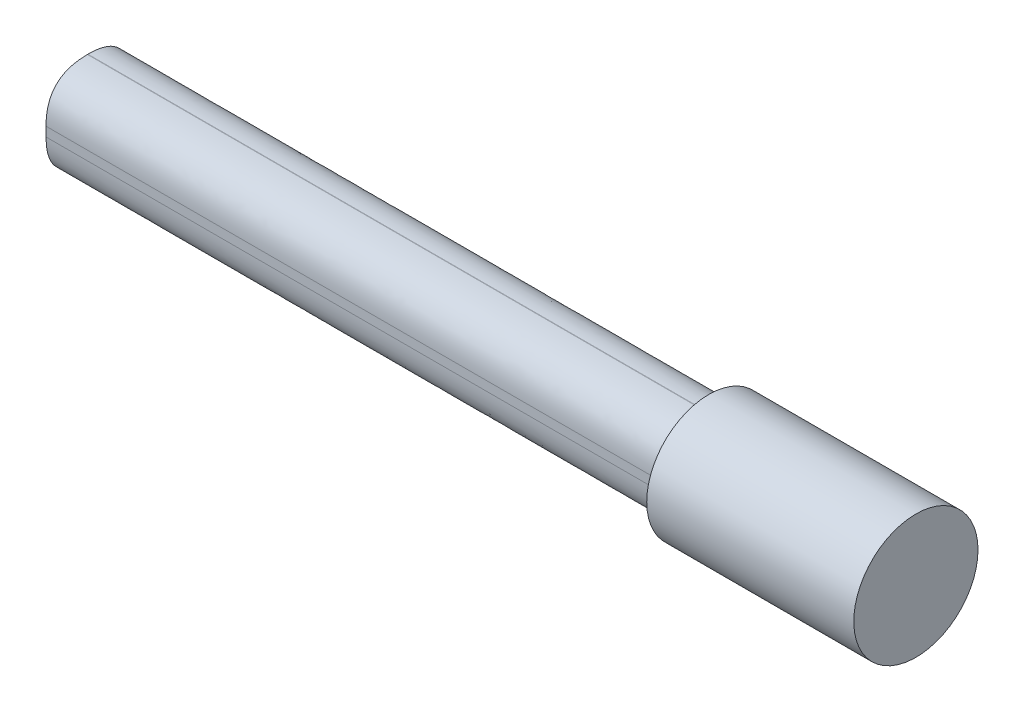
SolidWorks part; units mm, degrees
ref_plane "Front Plane" through (0, 0, 0) normal (0, 0, 1) x (1, 0, 0)
ref_plane "Top Plane" through (0, 0, 0) normal (0, 1, 0) x (1, 0, 0)
ref_plane "Right Plane" through (0, 0, 0) normal (1, 0, 0) x (0, 0, -1)
sketch "Sketch1" plane through (0, 0, 0) normal (1, 0, 0) x (0, 0, -1)
  circle A0 centre (0, 0) radius 3.81
  dimension "D1" = 7.62
extrude "Boss-Extrude1" add sketch "Sketch1" along normal blind 12.7
sketch "Sketch3" plane through (0, 0, 0) normal (1, 0, 0) x (0, 0, -1)
  circle A0 centre (0, 0) radius 12.9707
sketch "Sketch12" plane through (0, 0, 0) normal (-1, 0, 0) x (0, 0, 1)
  line L1 (2.5564, 2.825) -> (-2.5564, 2.825)
  line L2 (2.5564, 2.825) -> (2.5564, -2.825)
  line L3 (2.5564, -2.825) -> (-2.5564, -2.825)
  line L4 (-2.5564, 2.825) -> (-2.5564, -2.825)
  line L5 (2.5564, 2.825) -> (-2.5564, -2.825) construction
  line L6 (2.5564, -2.825) -> (-2.5564, 2.825) construction
  circle A0 centre (0, 0) radius 3.81 construction
  point P0 (0, 0)
sketch "Sketch16" plane through (0, 0, 0) normal (-1, 0, 0) x (0, 0, 1)
  circle A0 centre (0, 0) radius 11.7812
extrude "Boss-Extrude3" add sketch "Sketch12" along normal blind 38.1
fillet "Fillet2" radius 2.54 4 edges at (-19.05, -2.825, 2.5564) (-19.05, -2.825, -2.5564) (-19.05, 2.825, -2.5564) (-19.05, 2.825, 2.5564)
